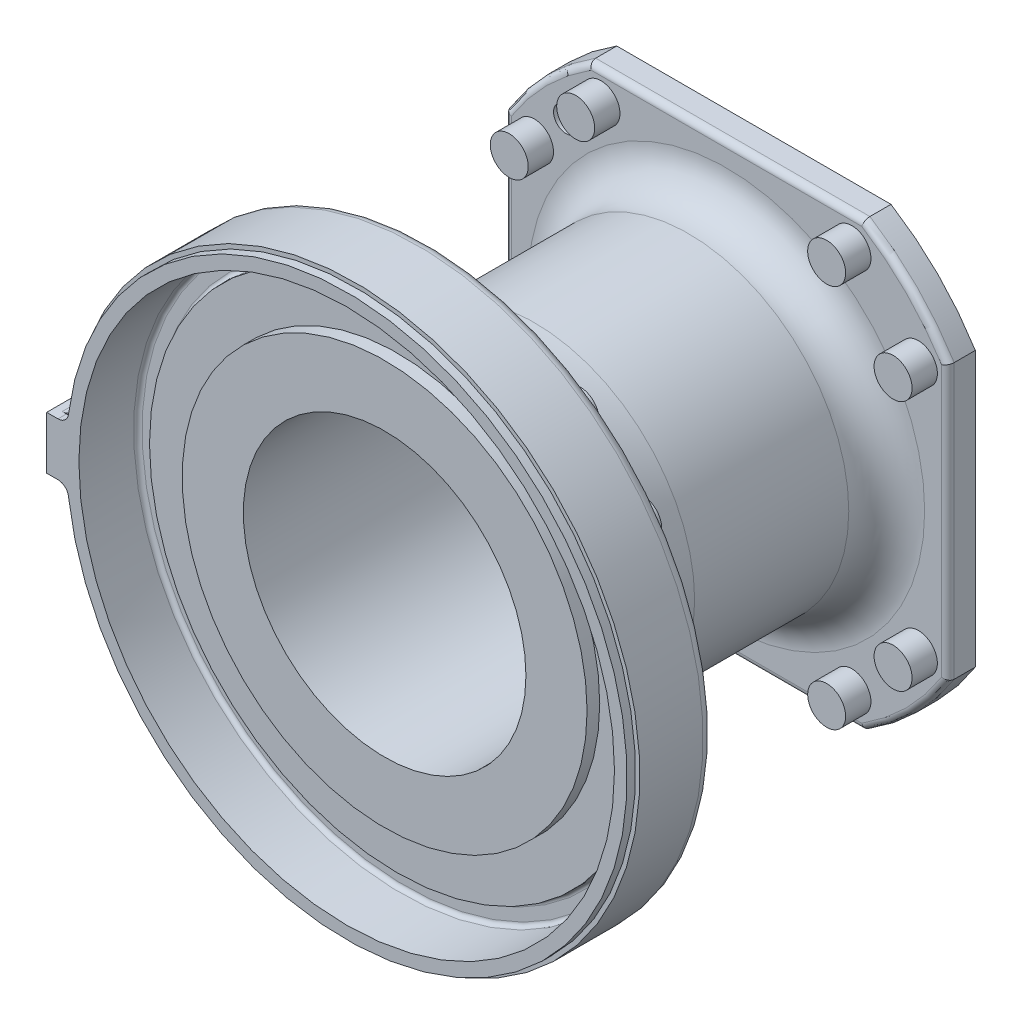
SolidWorks part; units mm, degrees
ref_plane "Front" through (0, 0, 0) normal (0, 0, 1) x (1, 0, 0)
ref_plane "Top" through (0, 0, 0) normal (0, 1, 0) x (1, 0, 0)
ref_plane "Right" through (0, 0, 0) normal (1, 0, 0) x (0, 0, -1)
imported_body "Imported1"
sketch "Sketch1" plane through (0, 0, 8) normal (0, 0, 1) x (1, 0, 0)
  circle A1 centre (0, 0) radius 96
  circle A2 centre (0, 0) radius 96
  dimension "D1" = 0
extrude "Extrude1" cut sketch "Sketch1" against normal blind 2
